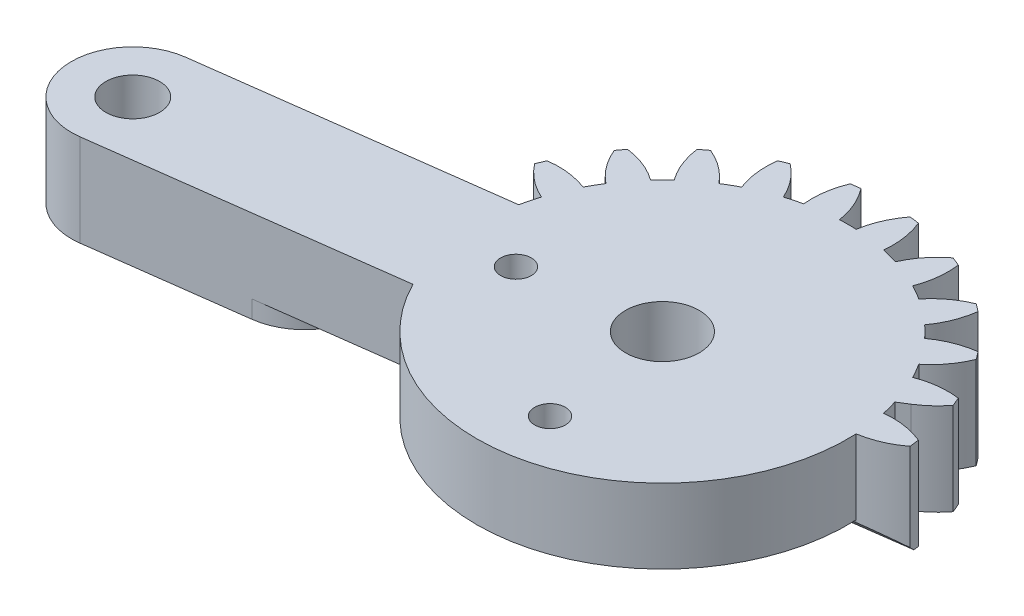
SolidWorks part; units mm, degrees
ref_plane "Front Plane" through (0, 0, 0) normal (0, 0, 1) x (1, 0, 0)
ref_plane "Top Plane" through (0, 0, 0) normal (0, 1, 0) x (1, 0, 0)
ref_plane "Right Plane" through (0, 0, 0) normal (1, 0, 0) x (0, 0, -1)
sketch "Sketch1" plane through (0, 0, 0) normal (0, 1, 0) x (1, 0, 0)
  line L0 (20.6437, 4) -> (2.0816, 4)
  line L1 (2.0816, -4) -> (20.6437, -4)
  arc A0 (2.0816, 4) -> (3.5217, 5.3071) centre (-0.7683, 8.5867) ccw
  arc A1 (3.5217, 5.3071) -> (3.2829, 5.8838) centre (-10.1063, 0) ccw
  arc A2 (3.2829, 5.8838) -> (0.6271, 5.5703) centre (2.5684, 0.5313) ccw
  arc A3 (0.6271, 5.5703) -> (0.0844, 6.5103) centre (-10.1063, 0) ccw
  arc A4 (0.0844, 6.5103) -> (1.6838, 8.6535) centre (-3.3089, 10.711) ccw
  arc A5 (1.6838, 8.6535) -> (1.3038, 9.1487) centre (-10.1063, 0) ccw
  arc A6 (1.3038, 9.1487) -> (-1.1803, 8.1585) centre (1.999, 3.7936) ccw
  arc A7 (-1.1803, 8.1585) -> (-1.9479, 8.926) centre (-10.1063, 0) ccw
  arc A8 (-1.9479, 8.926) -> (-0.9576, 11.4102) centre (-6.3127, 12.1053) ccw
  arc A9 (-0.9576, 11.4102) -> (-1.4528, 11.7901) centre (-10.1063, 0) ccw
  arc A10 (-1.4528, 11.7901) -> (-3.596, 10.1907) centre (0.6046, 6.7975) ccw
  arc A11 (-3.596, 10.1907) -> (-4.5361, 10.7334) centre (-10.1063, 0) ccw
  arc A12 (-4.5361, 10.7334) -> (-4.2225, 13.3892) centre (-9.5751, 12.6747) ccw
  arc A13 (-4.2225, 13.3892) -> (-4.7992, 13.6281) centre (-10.1063, 0) ccw
  arc A14 (-4.7992, 13.6281) -> (-6.4554, 11.5285) centre (-1.5196, 9.3381) ccw
  arc A15 (-6.4554, 11.5285) -> (-7.5039, 11.8094) centre (-10.1063, 0) ccw
  arc A16 (-7.5039, 11.8094) -> (-7.8884, 14.4558) centre (-12.8736, 12.3803) ccw
  arc A17 (-7.8884, 14.4558) -> (-8.5072, 14.5373) centre (-10.1063, 0) ccw
  arc A18 (-8.5072, 14.5373) -> (-9.5636, 12.0806) centre (-4.2291, 11.2423) ccw
  arc A19 (-9.5636, 12.0806) -> (-10.6491, 12.0806) centre (-10.1063, 0) ccw
  arc A20 (-10.6491, 12.0806) -> (-11.7054, 14.5373) centre (-15.9836, 11.2423) ccw
  arc A21 (-11.7054, 14.5373) -> (-12.3243, 14.4558) centre (-10.1063, 0) ccw
  arc A22 (-12.3243, 14.4558) -> (-12.7088, 11.8094) centre (-7.3391, 12.3803) ccw
  arc A23 (-12.7088, 11.8094) -> (-13.7573, 11.5285) centre (-10.1063, 0) ccw
  arc A24 (-13.7573, 11.5285) -> (-15.4135, 13.6281) centre (-18.6931, 9.3381) ccw
  arc A25 (-15.4135, 13.6281) -> (-15.9901, 13.3892) centre (-10.1063, 0) ccw
  arc A26 (-15.9901, 13.3892) -> (-15.6766, 10.7334) centre (-10.6376, 12.6747) ccw
  arc A27 (-15.6766, 10.7334) -> (-16.6166, 10.1907) centre (-10.1063, 0) ccw
  arc A28 (-16.6166, 10.1907) -> (-18.7599, 11.7901) centre (-20.8173, 6.7975) ccw
  arc A29 (-18.7599, 11.7901) -> (-19.255, 11.4102) centre (-10.1063, 0) ccw
  arc A30 (-19.255, 11.4102) -> (-18.2648, 8.926) centre (-13.9, 12.1053) ccw
  arc A31 (-18.2648, 8.926) -> (-19.0324, 8.1585) centre (-10.1063, 0) ccw
  arc A32 (-19.0324, 8.1585) -> (-21.5165, 9.1487) centre (-22.2117, 3.7936) ccw
  arc A33 (-21.5165, 9.1487) -> (-21.8965, 8.6535) centre (-10.1063, 0) ccw
  arc A34 (-21.8965, 8.6535) -> (-20.2971, 6.5103) centre (-16.9038, 10.711) ccw
  arc A35 (-20.2971, 6.5103) -> (-20.8398, 5.5703) centre (-10.1063, 0) ccw
  arc A36 (-20.8398, 5.5703) -> (-23.4956, 5.8838) centre (-22.7811, 0.5313) ccw
  arc A37 (-23.4956, 5.8838) -> (-23.7344, 5.3071) centre (-10.1063, 0) ccw
  arc A38 (-23.7344, 5.3071) -> (-21.6348, 3.6509) centre (-19.4444, 8.5867) ccw
  arc A39 (-21.6348, 3.6509) -> (-21.9157, 2.6025) centre (-10.1063, 0) ccw
  arc A40 (-21.9157, 2.6025) -> (-24.5622, 2.2179) centre (-22.4867, -2.7673) ccw
  arc A41 (-24.5622, 2.2179) -> (-24.6437, 1.5991) centre (-10.1063, 0) ccw
  arc A42 (-24.6437, 1.5991) -> (-22.1869, 0.5427) centre (-21.3486, 5.8773) ccw
  arc A43 (-22.1869, 0.5427) -> (-22.1869, -0.5427) centre (-10.1063, 0) ccw
  arc A44 (-22.1869, -0.5427) -> (-24.6437, -1.5991) centre (-21.3486, -5.8773) ccw
  arc A45 (-24.6437, -1.5991) -> (-24.5622, -2.2179) centre (-10.1063, 0) ccw
  arc A46 (-24.5622, -2.2179) -> (-21.9157, -2.6025) centre (-22.4867, 2.7673) ccw
  arc A47 (-21.9157, -2.6025) -> (-21.6348, -3.6509) centre (-10.1063, 0) ccw
  arc A48 (-21.6348, -3.6509) -> (-23.7344, -5.3071) centre (-19.4444, -8.5867) ccw
  arc A49 (-23.7344, -5.3071) -> (-23.4956, -5.8838) centre (-10.1063, 0) ccw
  arc A50 (-23.4956, -5.8838) -> (-20.8398, -5.5703) centre (-22.7811, -0.5313) ccw
  arc A51 (-20.8398, -5.5703) -> (-20.2971, -6.5103) centre (-10.1063, 0) ccw
  arc A52 (-20.2971, -6.5103) -> (-21.8965, -8.6535) centre (-16.9038, -10.711) ccw
  arc A53 (-21.8965, -8.6535) -> (-21.5165, -9.1487) centre (-10.1063, 0) ccw
  arc A54 (-21.5165, -9.1487) -> (-19.0324, -8.1585) centre (-22.2117, -3.7936) ccw
  arc A55 (-19.0324, -8.1585) -> (-18.2648, -8.926) centre (-10.1063, 0) ccw
  arc A56 (-18.2648, -8.926) -> (-19.255, -11.4102) centre (-13.9, -12.1053) ccw
  arc A57 (-19.255, -11.4102) -> (-18.7599, -11.7901) centre (-10.1063, 0) ccw
  arc A58 (-18.7599, -11.7901) -> (-16.6166, -10.1907) centre (-20.8173, -6.7975) ccw
  arc A59 (-16.6166, -10.1907) -> (-15.6766, -10.7334) centre (-10.1063, 0) ccw
  arc A60 (-15.6766, -10.7334) -> (-15.9901, -13.3892) centre (-10.6376, -12.6747) ccw
  arc A61 (-15.9901, -13.3892) -> (-15.4135, -13.6281) centre (-10.1063, 0) ccw
  arc A62 (-15.4135, -13.6281) -> (-13.7573, -11.5285) centre (-18.6931, -9.3381) ccw
  arc A63 (-13.7573, -11.5285) -> (-12.7088, -11.8094) centre (-10.1063, 0) ccw
  arc A64 (-12.7088, -11.8094) -> (-12.3243, -14.4558) centre (-7.3391, -12.3803) ccw
  arc A65 (-12.3243, -14.4558) -> (-11.7054, -14.5373) centre (-10.1063, 0) ccw
  arc A66 (-11.7054, -14.5373) -> (-10.6491, -12.0806) centre (-15.9836, -11.2423) ccw
  arc A67 (-10.6491, -12.0806) -> (-9.5636, -12.0806) centre (-10.1063, 0) ccw
  arc A68 (-9.5636, -12.0806) -> (-8.5072, -14.5373) centre (-4.2291, -11.2423) ccw
  arc A69 (-8.5072, -14.5373) -> (-7.8884, -14.4558) centre (-10.1063, 0) ccw
  arc A70 (-7.8884, -14.4558) -> (-7.5039, -11.8094) centre (-12.8736, -12.3803) ccw
  arc A71 (-7.5039, -11.8094) -> (-6.4554, -11.5285) centre (-10.1063, 0) ccw
  arc A72 (-6.4554, -11.5285) -> (-4.7992, -13.6281) centre (-1.5196, -9.3381) ccw
  arc A73 (-4.7992, -13.6281) -> (-4.2225, -13.3892) centre (-10.1063, 0) ccw
  arc A74 (-4.2225, -13.3892) -> (-4.5361, -10.7334) centre (-9.5751, -12.6747) ccw
  arc A75 (-4.5361, -10.7334) -> (-3.596, -10.1907) centre (-10.1063, 0) ccw
  arc A76 (-3.596, -10.1907) -> (-1.4528, -11.7901) centre (0.6046, -6.7975) ccw
  arc A77 (-1.4528, -11.7901) -> (-0.9576, -11.4102) centre (-10.1063, 0) ccw
  arc A78 (-0.9576, -11.4102) -> (-1.9479, -8.926) centre (-6.3127, -12.1053) ccw
  arc A79 (-1.9479, -8.926) -> (-1.1803, -8.1585) centre (-10.1063, 0) ccw
  arc A80 (-1.1803, -8.1585) -> (1.3038, -9.1487) centre (1.999, -3.7936) ccw
  arc A81 (1.3038, -9.1487) -> (1.6838, -8.6535) centre (-10.1063, 0) ccw
  arc A82 (1.6838, -8.6535) -> (0.0844, -6.5103) centre (-3.3089, -10.711) ccw
  arc A83 (0.0844, -6.5103) -> (0.6271, -5.5703) centre (-10.1063, 0) ccw
  arc A84 (0.6271, -5.5703) -> (3.2829, -5.8838) centre (2.5684, -0.5313) ccw
  arc A85 (3.2829, -5.8838) -> (3.5217, -5.3071) centre (-10.1063, 0) ccw
  arc A86 (3.5217, -5.3071) -> (2.0816, -4) centre (-0.7683, -8.5867) ccw
  arc A87 (20.6437, -4) -> (20.6437, 4) centre (20.6437, 0) ccw
  circle A88 centre (-10.1063, 0) radius 1.5
  circle A89 centre (20.6437, 0) radius 1.5
  dimension "D1" = 3
  dimension "D2" = 3
extrude "Boss-Extrude1" add sketch "Sketch1" along normal blind 4
sketch "Sketch3" plane through (0, 4, 0) normal (0, 1, 0) x (1, 0, 0)
  line L0 (-10.1063, 0) -> (-40.8563, 0) construction
  line L1 (-10.1063, 0) -> (-40.5933, -4.0137)
  line L2 (-10.6284, 3.9658) -> (-41.1154, -0.0479)
  line L3 (-9.5842, -3.9658) -> (-40.0712, -7.9795)
  line L4 (-10.1063, 0) -> (-4.5096, 13.5117) construction
  line L5 (-10.1063, 0) -> (-8.1974, 14.4999) construction
  circle A0 centre (-10.1063, 0) radius 1.5
  circle A1 centre (20.6437, 0) radius 1.5 construction
  circle A2 centre (20.6437, 0) radius 1.5
  circle A3 centre (-40.5933, -4.0137) radius 1.75
  circle A4 centre (-40.5933, -4.0137) radius 4
  circle A5 centre (-10.1063, 0) radius 4
  arc A6 (-4.2225, 13.3892) -> (-4.7992, 13.6281) centre (-10.1063, 0) ccw construction
  arc A7 (-7.8884, 14.4558) -> (-8.5072, 14.5373) centre (-10.1063, 0) ccw construction
  dimension "D2" = 3
  dimension "D5" = 3.5
  dimension "D6" = 8
  dimension "D7" = 8
  dimension "D1" = 30.75
  dimension "D4" = 7.5
extrude "Boss-Extrude2" add sketch "Sketch3" against normal blind 4
sketch "Sketch4" plane through (0, 4, 0) normal (0, 1, 0) x (1, 0, 0)
  line L0 (20.6437, 4) -> (2.0816, 4) construction
  line L1 (2.0816, -4) -> (20.6437, -4) construction
  line L2 (20.6437, 4) -> (2.0816, 4)
  line L3 (2.0816, -4) -> (20.6437, -4)
  line L4 (2.0816, 4) -> (1.4381, 3.6001)
  line L5 (-21.6245, -5.5509) -> (-20.8986, -5.4553)
  line L6 (-10.1063, 0) -> (0.0844, 6.5103) construction
  line L7 (-10.1063, 0) -> (1.9742, 0.5427) construction
  line L8 (-24.5755, 2.1296) -> (-41.1154, -0.0479)
  line L9 (-40.0712, -7.9795) -> (-23.5312, -5.8019)
  line L10 (2.0816, -4) -> (20.6437, -4)
  line L11 (20.6437, 4) -> (2.0816, 4)
  line L12 (-21.9429, 2.4762) -> (-41.1154, -0.0479)
  line L13 (-40.0712, -7.9795) -> (-21.6245, -5.5509)
  line L14 (2.0816, -4) -> (20.6437, -4)
  line L15 (20.6437, 4) -> (2.0816, 4)
  circle A0 centre (-10.1063, 0) radius 12.0927
  arc A1 (3.2829, 5.8838) -> (0.6271, 5.5703) centre (2.5684, 0.5313) ccw construction
  arc A2 (3.5217, 5.3071) -> (3.2829, 5.8838) centre (-10.1063, 0) ccw construction
  arc A3 (2.0816, 4) -> (3.5217, 5.3071) centre (-0.7683, 8.5867) ccw construction
  arc A4 (20.6437, -4) -> (20.6437, 4) centre (20.6437, 0) ccw construction
  arc A5 (3.5217, -5.3071) -> (2.0816, -4) centre (-0.7683, -8.5867) ccw construction
  arc A6 (3.2829, -5.8838) -> (3.5217, -5.3071) centre (-10.1063, 0) ccw construction
  arc A7 (0.6271, -5.5703) -> (3.2829, -5.8838) centre (2.5684, -0.5313) ccw construction
  arc A8 (3.2829, 5.8838) -> (0.6271, 5.5703) centre (2.5684, 0.5313) ccw
  arc A9 (3.5217, 5.3071) -> (3.2829, 5.8838) centre (-10.1063, 0) ccw
  arc A10 (2.0816, 4) -> (3.5217, 5.3071) centre (-0.7683, 8.5867) ccw
  arc A11 (20.6437, -4) -> (20.6437, 4) centre (20.6437, 0) ccw
  arc A12 (3.5217, -5.3071) -> (2.0816, -4) centre (-0.7683, -8.5867) ccw
  arc A13 (3.2829, -5.8838) -> (3.5217, -5.3071) centre (-10.1063, 0) ccw
  arc A14 (0.6271, -5.5703) -> (3.2829, -5.8838) centre (2.5684, -0.5313) ccw
  arc A15 (1.9742, 0.5427) -> (4.431, 1.5991) centre (1.1359, 5.8773) ccw
  arc A16 (4.3495, 2.2179) -> (1.7031, 2.6025) centre (2.274, -2.7673) ccw
  arc A17 (4.431, 1.5991) -> (4.3495, 2.2179) centre (-10.1063, 0) ccw
  arc A95 (-21.6348, 3.6509) -> (-21.9157, 2.6025) centre (-10.1063, 0) ccw
  arc A96 (-41.1154, -0.0479) -> (-40.0712, -7.9795) centre (-40.5933, -4.0137) ccw
  arc A97 (-20.2971, -6.5103) -> (-21.8965, -8.6535) centre (-16.9038, -10.711) ccw
  arc A98 (-21.8965, -8.6535) -> (-21.5165, -9.1487) centre (-10.1063, 0) ccw
  arc A99 (-21.5165, -9.1487) -> (-19.0324, -8.1585) centre (-22.2117, -3.7936) ccw
  arc A100 (-19.0324, -8.1585) -> (-18.2648, -8.926) centre (-10.1063, 0) ccw
  arc A101 (-18.2648, -8.926) -> (-19.255, -11.4102) centre (-13.9, -12.1053) ccw
  arc A102 (-19.255, -11.4102) -> (-18.7599, -11.7901) centre (-10.1063, 0) ccw
  arc A103 (-18.7599, -11.7901) -> (-16.6166, -10.1907) centre (-20.8173, -6.7975) ccw
  arc A104 (-16.6166, -10.1907) -> (-15.6766, -10.7334) centre (-10.1063, 0) ccw
  arc A105 (-15.6766, -10.7334) -> (-15.9901, -13.3892) centre (-10.6376, -12.6747) ccw
  arc A106 (-15.9901, -13.3892) -> (-15.4135, -13.6281) centre (-10.1063, 0) ccw
  arc A107 (-15.4135, -13.6281) -> (-13.7573, -11.5285) centre (-18.6931, -9.3381) ccw
  arc A108 (-13.7573, -11.5285) -> (-12.7088, -11.8094) centre (-10.1063, 0) ccw
  arc A109 (-12.7088, -11.8094) -> (-12.3243, -14.4558) centre (-7.3391, -12.3803) ccw
  arc A110 (-12.3243, -14.4558) -> (-11.7054, -14.5373) centre (-10.1063, 0) ccw
  arc A111 (-11.7054, -14.5373) -> (-10.6491, -12.0806) centre (-15.9836, -11.2423) ccw
  arc A112 (-10.6491, -12.0806) -> (-9.5636, -12.0806) centre (-10.1063, 0) ccw
  arc A113 (-9.5636, -12.0806) -> (-8.5072, -14.5373) centre (-4.2291, -11.2423) ccw
  arc A114 (-8.5072, -14.5373) -> (-7.8884, -14.4558) centre (-10.1063, 0) ccw
  arc A115 (-7.8884, -14.4558) -> (-7.5039, -11.8094) centre (-12.8736, -12.3803) ccw
  arc A116 (-7.5039, -11.8094) -> (-6.4554, -11.5285) centre (-10.1063, 0) ccw
  arc A117 (-6.4554, -11.5285) -> (-4.7992, -13.6281) centre (-1.5196, -9.3381) ccw
  arc A118 (-4.7992, -13.6281) -> (-4.2225, -13.3892) centre (-10.1063, 0) ccw
  arc A119 (-4.2225, -13.3892) -> (-4.5361, -10.7334) centre (-9.5751, -12.6747) ccw
  arc A120 (-4.5361, -10.7334) -> (-3.596, -10.1907) centre (-10.1063, 0) ccw
  arc A121 (-3.596, -10.1907) -> (-1.4528, -11.7901) centre (0.6046, -6.7975) ccw
  arc A122 (-1.4528, -11.7901) -> (-0.9576, -11.4102) centre (-10.1063, 0) ccw
  arc A123 (-0.9576, -11.4102) -> (-1.9479, -8.926) centre (-6.3127, -12.1053) ccw
  arc A124 (-1.9479, -8.926) -> (-1.1803, -8.1585) centre (-10.1063, 0) ccw
  arc A125 (-1.1803, -8.1585) -> (1.3038, -9.1487) centre (1.999, -3.7936) ccw
  arc A126 (1.3038, -9.1487) -> (1.6838, -8.6535) centre (-10.1063, 0) ccw
  arc A127 (1.6838, -8.6535) -> (0.0844, -6.5103) centre (-3.3089, -10.711) ccw
  arc A128 (0.0844, -6.5103) -> (0.6271, -5.5703) centre (-10.1063, 0) ccw
  arc A129 (0.6271, -5.5703) -> (3.2829, -5.8838) centre (2.5684, -0.5313) ccw
  arc A130 (3.2829, -5.8838) -> (3.5217, -5.3071) centre (-10.1063, 0) ccw
  arc A131 (3.5217, -5.3071) -> (2.0816, -4) centre (-0.7683, -8.5867) ccw
  arc A132 (20.6437, -4) -> (20.6437, 4) centre (20.6437, 0) ccw
  arc A133 (2.0816, 4) -> (3.5217, 5.3071) centre (-0.7683, 8.5867) ccw
  arc A134 (3.5217, 5.3071) -> (3.2829, 5.8838) centre (-10.1063, 0) ccw
  arc A135 (3.2829, 5.8838) -> (0.6271, 5.5703) centre (2.5684, 0.5313) ccw
  arc A136 (0.6271, 5.5703) -> (0.0844, 6.5103) centre (-10.1063, 0) ccw
  arc A137 (0.0844, 6.5103) -> (1.6838, 8.6535) centre (-3.3089, 10.711) ccw
  arc A138 (1.6838, 8.6535) -> (1.3038, 9.1487) centre (-10.1063, 0) ccw
  arc A139 (1.3038, 9.1487) -> (-1.1803, 8.1585) centre (1.999, 3.7936) ccw
  arc A140 (-1.1803, 8.1585) -> (-1.9479, 8.926) centre (-10.1063, 0) ccw
  arc A141 (-1.9479, 8.926) -> (-0.9576, 11.4102) centre (-6.3127, 12.1053) ccw
  arc A142 (-0.9576, 11.4102) -> (-1.4528, 11.7901) centre (-10.1063, 0) ccw
  arc A143 (-1.4528, 11.7901) -> (-3.596, 10.1907) centre (0.6046, 6.7975) ccw
  arc A144 (-3.596, 10.1907) -> (-4.5361, 10.7334) centre (-10.1063, 0) ccw
  arc A145 (-4.5361, 10.7334) -> (-4.2225, 13.3892) centre (-9.5751, 12.6747) ccw
  arc A146 (-4.2225, 13.3892) -> (-4.7992, 13.6281) centre (-10.1063, 0) ccw
  arc A147 (-4.7992, 13.6281) -> (-6.4554, 11.5285) centre (-1.5196, 9.3381) ccw
  arc A148 (-6.4554, 11.5285) -> (-7.5039, 11.8094) centre (-10.1063, 0) ccw
  arc A149 (-7.5039, 11.8094) -> (-7.8884, 14.4558) centre (-12.8736, 12.3803) ccw
  arc A150 (-7.8884, 14.4558) -> (-8.5072, 14.5373) centre (-10.1063, 0) ccw
  arc A151 (-8.5072, 14.5373) -> (-9.5636, 12.0806) centre (-4.2291, 11.2423) ccw
  arc A152 (-9.5636, 12.0806) -> (-10.6491, 12.0806) centre (-10.1063, 0) ccw
  arc A153 (-10.6491, 12.0806) -> (-11.7054, 14.5373) centre (-15.9836, 11.2423) ccw
  arc A154 (-11.7054, 14.5373) -> (-12.3243, 14.4558) centre (-10.1063, 0) ccw
  arc A155 (-12.3243, 14.4558) -> (-12.7088, 11.8094) centre (-7.3391, 12.3803) ccw
  arc A156 (-12.7088, 11.8094) -> (-13.7573, 11.5285) centre (-10.1063, 0) ccw
  arc A157 (-13.7573, 11.5285) -> (-15.4135, 13.6281) centre (-18.6931, 9.3381) ccw
  arc A158 (-15.4135, 13.6281) -> (-15.9901, 13.3892) centre (-10.1063, 0) ccw
  arc A159 (-15.9901, 13.3892) -> (-15.6766, 10.7334) centre (-10.6376, 12.6747) ccw
  arc A160 (-15.6766, 10.7334) -> (-16.6166, 10.1907) centre (-10.1063, 0) ccw
  arc A161 (-16.6166, 10.1907) -> (-18.7599, 11.7901) centre (-20.8173, 6.7975) ccw
  arc A162 (-18.7599, 11.7901) -> (-19.255, 11.4102) centre (-10.1063, 0) ccw
  arc A163 (-19.255, 11.4102) -> (-18.2648, 8.926) centre (-13.9, 12.1053) ccw
  arc A164 (-18.2648, 8.926) -> (-19.0324, 8.1585) centre (-10.1063, 0) ccw
  arc A165 (-19.0324, 8.1585) -> (-21.5165, 9.1487) centre (-22.2117, 3.7936) ccw
  arc A166 (-21.5165, 9.1487) -> (-21.8965, 8.6535) centre (-10.1063, 0) ccw
  arc A167 (-21.8965, 8.6535) -> (-20.2971, 6.5103) centre (-16.9038, 10.711) ccw
  arc A168 (-20.2971, 6.5103) -> (-20.8398, 5.5703) centre (-10.1063, 0) ccw
  arc A169 (-20.8398, 5.5703) -> (-23.4956, 5.8838) centre (-22.7811, 0.5313) ccw
  arc A170 (-23.4956, 5.8838) -> (-23.7344, 5.3071) centre (-10.1063, 0) ccw
  arc A171 (-23.7344, 5.3071) -> (-21.6348, 3.6509) centre (-19.4444, 8.5867) ccw
  arc A172 (-21.6348, 3.6509) -> (-21.9157, 2.6025) centre (-10.1063, 0) ccw
  arc A175 (-23.4956, -5.8838) -> (-20.8398, -5.5703) centre (-22.7811, -0.5313) ccw
  arc A176 (-41.1154, -0.0479) -> (-40.0712, -7.9795) centre (-40.5933, -4.0137) ccw
  arc A177 (-20.2971, -6.5103) -> (-21.8965, -8.6535) centre (-16.9038, -10.711) ccw
  arc A178 (-21.8965, -8.6535) -> (-21.5165, -9.1487) centre (-10.1063, 0) ccw
  arc A179 (-21.5165, -9.1487) -> (-19.0324, -8.1585) centre (-22.2117, -3.7936) ccw
  arc A180 (-19.0324, -8.1585) -> (-18.2648, -8.926) centre (-10.1063, 0) ccw
  arc A181 (-18.2648, -8.926) -> (-19.255, -11.4102) centre (-13.9, -12.1053) ccw
  arc A182 (-19.255, -11.4102) -> (-18.7599, -11.7901) centre (-10.1063, 0) ccw
  arc A183 (-18.7599, -11.7901) -> (-16.6166, -10.1907) centre (-20.8173, -6.7975) ccw
  arc A184 (-16.6166, -10.1907) -> (-15.6766, -10.7334) centre (-10.1063, 0) ccw
  arc A185 (-15.6766, -10.7334) -> (-15.9901, -13.3892) centre (-10.6376, -12.6747) ccw
  arc A186 (-15.9901, -13.3892) -> (-15.4135, -13.6281) centre (-10.1063, 0) ccw
  arc A187 (-15.4135, -13.6281) -> (-13.7573, -11.5285) centre (-18.6931, -9.3381) ccw
  arc A188 (-13.7573, -11.5285) -> (-12.7088, -11.8094) centre (-10.1063, 0) ccw
  arc A189 (-12.7088, -11.8094) -> (-12.3243, -14.4558) centre (-7.3391, -12.3803) ccw
  arc A190 (-12.3243, -14.4558) -> (-11.7054, -14.5373) centre (-10.1063, 0) ccw
  arc A191 (-11.7054, -14.5373) -> (-10.6491, -12.0806) centre (-15.9836, -11.2423) ccw
  arc A192 (-10.6491, -12.0806) -> (-9.5636, -12.0806) centre (-10.1063, 0) ccw
  arc A193 (-9.5636, -12.0806) -> (-8.5072, -14.5373) centre (-4.2291, -11.2423) ccw
  arc A194 (-8.5072, -14.5373) -> (-7.8884, -14.4558) centre (-10.1063, 0) ccw
  arc A195 (-7.8884, -14.4558) -> (-7.5039, -11.8094) centre (-12.8736, -12.3803) ccw
  arc A196 (-7.5039, -11.8094) -> (-6.4554, -11.5285) centre (-10.1063, 0) ccw
  arc A197 (-6.4554, -11.5285) -> (-4.7992, -13.6281) centre (-1.5196, -9.3381) ccw
  arc A198 (-4.7992, -13.6281) -> (-4.2225, -13.3892) centre (-10.1063, 0) ccw
  arc A199 (-4.2225, -13.3892) -> (-4.5361, -10.7334) centre (-9.5751, -12.6747) ccw
  arc A200 (-4.5361, -10.7334) -> (-3.596, -10.1907) centre (-10.1063, 0) ccw
  arc A201 (-3.596, -10.1907) -> (-1.4528, -11.7901) centre (0.6046, -6.7975) ccw
  arc A202 (-1.4528, -11.7901) -> (-0.9576, -11.4102) centre (-10.1063, 0) ccw
  arc A203 (-0.9576, -11.4102) -> (-1.9479, -8.926) centre (-6.3127, -12.1053) ccw
  arc A204 (-1.9479, -8.926) -> (-1.1803, -8.1585) centre (-10.1063, 0) ccw
  arc A205 (-1.1803, -8.1585) -> (1.3038, -9.1487) centre (1.999, -3.7936) ccw
  arc A206 (1.3038, -9.1487) -> (1.6838, -8.6535) centre (-10.1063, 0) ccw
  arc A207 (1.6838, -8.6535) -> (0.0844, -6.5103) centre (-3.3089, -10.711) ccw
  arc A208 (0.0844, -6.5103) -> (0.6271, -5.5703) centre (-10.1063, 0) ccw
  arc A209 (0.6271, -5.5703) -> (3.2829, -5.8838) centre (2.5684, -0.5313) ccw
  arc A210 (3.2829, -5.8838) -> (3.5217, -5.3071) centre (-10.1063, 0) ccw
  arc A211 (3.5217, -5.3071) -> (2.0816, -4) centre (-0.7683, -8.5867) ccw
  arc A212 (20.6437, -4) -> (20.6437, 4) centre (20.6437, 0) ccw
  arc A213 (2.0816, 4) -> (3.5217, 5.3071) centre (-0.7683, 8.5867) ccw
  arc A214 (3.5217, 5.3071) -> (3.2829, 5.8838) centre (-10.1063, 0) ccw
  arc A215 (3.2829, 5.8838) -> (0.6271, 5.5703) centre (2.5684, 0.5313) ccw
  arc A216 (0.6271, 5.5703) -> (0.0844, 6.5103) centre (-10.1063, 0) ccw
  arc A217 (0.0844, 6.5103) -> (1.6838, 8.6535) centre (-3.3089, 10.711) ccw
  arc A218 (1.6838, 8.6535) -> (1.3038, 9.1487) centre (-10.1063, 0) ccw
  arc A219 (1.3038, 9.1487) -> (-1.1803, 8.1585) centre (1.999, 3.7936) ccw
  arc A220 (-1.1803, 8.1585) -> (-1.9479, 8.926) centre (-10.1063, 0) ccw
  arc A221 (-1.9479, 8.926) -> (-0.9576, 11.4102) centre (-6.3127, 12.1053) ccw
  arc A222 (-0.9576, 11.4102) -> (-1.4528, 11.7901) centre (-10.1063, 0) ccw
  arc A223 (-1.4528, 11.7901) -> (-3.596, 10.1907) centre (0.6046, 6.7975) ccw
  arc A224 (-3.596, 10.1907) -> (-4.5361, 10.7334) centre (-10.1063, 0) ccw
  arc A225 (-4.5361, 10.7334) -> (-4.2225, 13.3892) centre (-9.5751, 12.6747) ccw
  arc A226 (-4.2225, 13.3892) -> (-4.7992, 13.6281) centre (-10.1063, 0) ccw
  arc A227 (-4.7992, 13.6281) -> (-6.4554, 11.5285) centre (-1.5196, 9.3381) ccw
  arc A228 (-6.4554, 11.5285) -> (-7.5039, 11.8094) centre (-10.1063, 0) ccw
  arc A229 (-7.5039, 11.8094) -> (-7.8884, 14.4558) centre (-12.8736, 12.3803) ccw
  arc A230 (-7.8884, 14.4558) -> (-8.5072, 14.5373) centre (-10.1063, 0) ccw
  arc A231 (-8.5072, 14.5373) -> (-9.5636, 12.0806) centre (-4.2291, 11.2423) ccw
  arc A232 (-9.5636, 12.0806) -> (-10.6491, 12.0806) centre (-10.1063, 0) ccw
  arc A233 (-10.6491, 12.0806) -> (-11.7054, 14.5373) centre (-15.9836, 11.2423) ccw
  arc A234 (-11.7054, 14.5373) -> (-12.3243, 14.4558) centre (-10.1063, 0) ccw
  arc A235 (-12.3243, 14.4558) -> (-12.7088, 11.8094) centre (-7.3391, 12.3803) ccw
  arc A236 (-12.7088, 11.8094) -> (-13.7573, 11.5285) centre (-10.1063, 0) ccw
  arc A237 (-13.7573, 11.5285) -> (-15.4135, 13.6281) centre (-18.6931, 9.3381) ccw
  arc A238 (-15.4135, 13.6281) -> (-15.9901, 13.3892) centre (-10.1063, 0) ccw
  arc A239 (-15.9901, 13.3892) -> (-15.6766, 10.7334) centre (-10.6376, 12.6747) ccw
  arc A240 (-15.6766, 10.7334) -> (-16.6166, 10.1907) centre (-10.1063, 0) ccw
  arc A241 (-16.6166, 10.1907) -> (-18.7599, 11.7901) centre (-20.8173, 6.7975) ccw
  arc A242 (-18.7599, 11.7901) -> (-19.255, 11.4102) centre (-10.1063, 0) ccw
  arc A243 (-19.255, 11.4102) -> (-18.2648, 8.926) centre (-13.9, 12.1053) ccw
  arc A244 (-18.2648, 8.926) -> (-19.0324, 8.1585) centre (-10.1063, 0) ccw
  arc A245 (-19.0324, 8.1585) -> (-21.5165, 9.1487) centre (-22.2117, 3.7936) ccw
  arc A246 (-21.5165, 9.1487) -> (-21.8965, 8.6535) centre (-10.1063, 0) ccw
  arc A247 (-21.8965, 8.6535) -> (-20.2971, 6.5103) centre (-16.9038, 10.711) ccw
  arc A248 (-20.2971, 6.5103) -> (-20.8398, 5.5703) centre (-10.1063, 0) ccw
  arc A249 (-20.8398, 5.5703) -> (-23.4956, 5.8838) centre (-22.7811, 0.5313) ccw
  arc A250 (-23.4956, 5.8838) -> (-23.7344, 5.3071) centre (-10.1063, 0) ccw
  arc A251 (-23.7344, 5.3071) -> (-21.6348, 3.6509) centre (-19.4444, 8.5867) ccw
  arc A252 (-23.4956, -5.8838) -> (-20.8398, -5.5703) centre (-22.7811, -0.5313) ccw
  arc A253 (-20.8398, -5.5703) -> (-20.2971, -6.5103) centre (-10.1063, 0) ccw
  arc A254 (-20.8398, -5.5703) -> (-20.2971, -6.5103) centre (-10.1063, 0) ccw
  arc A255 (-23.5312, -5.8019) -> (-23.4956, -5.8838) centre (-10.1063, 0) ccw
  arc A256 (-23.5312, -5.8019) -> (-23.4956, -5.8838) centre (-10.1063, 0) ccw
  arc A257 (-21.9157, 2.6025) -> (-24.5622, 2.2179) centre (-22.4867, -2.7673) ccw
  arc A258 (-21.9157, 2.6025) -> (-24.5622, 2.2179) centre (-22.4867, -2.7673) ccw
  arc A259 (-24.5622, 2.2179) -> (-24.5755, 2.1296) centre (-10.1063, 0) ccw
  arc A260 (-24.5622, 2.2179) -> (-24.5755, 2.1296) centre (-10.1063, 0) ccw
  point P40 (-10.1063, 0)
  dimension "D2" = 24.1855
  dimension "D4" = 30
  dimension "D1" = 0
  dimension "D3" = 2
extrude "Cut-Extrude1" cut sketch "Sketch4" against normal blind 4 contours A178 A179 A0 L5 A177 | A182 A183 A0 A181 | A186 A187 A0 A185 | A190 A191 A0 A189 | A194 A195 A0 A193 | A198 A199 A0 A197 | A202 A203 A0 A201 | A206 A207 A0 A205 | A258 A260 L12 A0 | L13 A256 A252 A0 L5 | A0 A14 A13 A12 L3 A11 L2 L4
sketch "Sketch5" plane through (0, 4, 0) normal (0, 1, 0) x (1, 0, 0)
  line L0 (-10.1063, 0) -> (-40.5933, -4.0137) construction
  line L1 (-10.1063, 0) -> (-8.9969, -8.4273) construction
  circle A0 centre (-10.1063, 0) radius 2.4
  circle A2 centre (-14.5678, -0.5874) radius 1
  circle A4 centre (-18.5336, -1.1095) radius 1
  circle A6 centre (-8.9969, -8.4273) radius 1
  dimension "D1" = 4.8
  dimension "D2" = 4.5
  dimension "D3" = 2
  dimension "D4" = 2
  dimension "D6" = 90
  dimension "D7" = 8.5
  dimension "D8" = 2
  dimension "D5" = 4
extrude "Cut-Extrude2" cut sketch "Sketch5" against normal up to next contours A0 | A4 | A6
sketch "Sketch7" plane through (0, 4, 0) normal (0, 1, 0) x (1, 0, 0)
  circle A0 centre (-10.1063, 0) radius 13.45 construction
  circle A1 centre (-10.1063, 0) radius 13.45
sketch "Sketch8" plane through (0, 0, 0) normal (0, -1, 0) x (1, 0, 0)
  line L0 (-30.6788, 2.7084) -> (-40.5933, 4.0137) construction
  line L1 (-20.8986, 5.4553) -> (-40.0712, 7.9795) construction
  line L2 (-30.1567, 6.6742) -> (-40.0712, 7.9795)
  line L3 (-21.9429, -2.4762) -> (-41.1154, 0.0479) construction
  line L4 (-31.2009, -1.2574) -> (-41.1154, 0.0479)
  arc A0 (-31.2009, -1.2574) -> (-30.1567, 6.6742) centre (-30.6788, 2.7084) ccw
  arc A1 (-40.0712, 7.9795) -> (-41.1154, 0.0479) centre (-40.5933, 4.0137) ccw construction
  arc A2 (-40.0712, 7.9795) -> (-41.1154, 0.0479) centre (-40.5933, 4.0137) ccw
  circle A3 centre (-40.5933, 4.0137) radius 1.75 construction
  circle A4 centre (-40.5933, 4.0137) radius 1.75
  dimension "D1" = 10
extrude "Boss-Extrude3" add sketch "Sketch8" along normal blind 2
sketch "Sketch10" plane through (0, 0, 0) normal (0, -1, 0) x (1, 0, 0)
  line L1 (1.9742, -0.5427) -> (-2.0136, 0)
  line L2 (-21.9429, -2.4762) -> (-17.6034, -3.0475)
  line L3 (-31.2009, -1.2574) -> (-21.9429, -2.4762)
  line L4 (2.0816, -4) -> (1.4381, -3.6001)
  line L5 (-20.8986, 5.4553) -> (-30.1567, 6.6742)
  line L7 (2.0816, -4) -> (1.4381, -3.6001)
  line L8 (-20.8986, 5.4553) -> (-30.1567, 6.6742)
  line L9 (-21.9429, -2.4762) -> (-31.2009, -1.2574) construction
  arc A0 (-17.6034, -3.0475) -> (-2.0136, 0) centre (-10.1063, 0) ccw
  circle A1 centre (-10.1063, 0) radius 7 construction
  arc A46 (-31.2009, -1.2574) -> (-30.1567, 6.6742) centre (-30.6788, 2.7084) ccw
  arc A47 (-21.9429, -2.4762) -> (-21.6348, -3.6509) centre (-10.1063, 0) ccw
  arc A48 (-21.6348, -3.6509) -> (-23.7344, -5.3071) centre (-19.4444, -8.5867) ccw
  arc A49 (-23.7344, -5.3071) -> (-23.4956, -5.8838) centre (-10.1063, 0) ccw
  arc A50 (-23.4956, -5.8838) -> (-20.8398, -5.5703) centre (-22.7811, -0.5313) ccw
  arc A51 (-20.8398, -5.5703) -> (-20.2971, -6.5103) centre (-10.1063, 0) ccw
  arc A52 (-20.2971, -6.5103) -> (-21.8965, -8.6535) centre (-16.9038, -10.711) ccw
  arc A53 (-21.8965, -8.6535) -> (-21.5165, -9.1487) centre (-10.1063, 0) ccw
  arc A54 (-21.5165, -9.1487) -> (-19.0324, -8.1585) centre (-22.2117, -3.7936) ccw
  arc A55 (-19.0324, -8.1585) -> (-18.2648, -8.926) centre (-10.1063, 0) ccw
  arc A56 (-18.2648, -8.926) -> (-19.255, -11.4102) centre (-13.9, -12.1053) ccw
  arc A57 (-19.255, -11.4102) -> (-18.7599, -11.7901) centre (-10.1063, 0) ccw
  arc A58 (-18.7599, -11.7901) -> (-16.6166, -10.1907) centre (-20.8173, -6.7975) ccw
  arc A59 (-16.6166, -10.1907) -> (-15.6766, -10.7334) centre (-10.1063, 0) ccw
  arc A60 (-15.6766, -10.7334) -> (-15.9901, -13.3892) centre (-10.6376, -12.6747) ccw
  arc A61 (-15.9901, -13.3892) -> (-15.4135, -13.6281) centre (-10.1063, 0) ccw
  arc A62 (-15.4135, -13.6281) -> (-13.7573, -11.5285) centre (-18.6931, -9.3381) ccw
  arc A63 (-13.7573, -11.5285) -> (-12.7088, -11.8094) centre (-10.1063, 0) ccw
  arc A64 (-12.7088, -11.8094) -> (-12.3243, -14.4558) centre (-7.3391, -12.3803) ccw
  arc A65 (-12.3243, -14.4558) -> (-11.7054, -14.5373) centre (-10.1063, 0) ccw
  arc A66 (-11.7054, -14.5373) -> (-10.6491, -12.0806) centre (-15.9836, -11.2423) ccw
  arc A67 (-10.6491, -12.0806) -> (-9.5636, -12.0806) centre (-10.1063, 0) ccw
  arc A68 (-9.5636, -12.0806) -> (-8.5072, -14.5373) centre (-4.2291, -11.2423) ccw
  arc A69 (-8.5072, -14.5373) -> (-7.8884, -14.4558) centre (-10.1063, 0) ccw
  arc A70 (-7.8884, -14.4558) -> (-7.5039, -11.8094) centre (-12.8736, -12.3803) ccw
  arc A71 (-7.5039, -11.8094) -> (-6.4554, -11.5285) centre (-10.1063, 0) ccw
  arc A72 (-6.4554, -11.5285) -> (-4.7992, -13.6281) centre (-1.5196, -9.3381) ccw
  arc A73 (-4.7992, -13.6281) -> (-4.2225, -13.3892) centre (-10.1063, 0) ccw
  arc A74 (-4.2225, -13.3892) -> (-4.5361, -10.7334) centre (-9.5751, -12.6747) ccw
  arc A75 (-4.5361, -10.7334) -> (-3.596, -10.1907) centre (-10.1063, 0) ccw
  arc A76 (-3.596, -10.1907) -> (-1.4528, -11.7901) centre (0.6046, -6.7975) ccw
  arc A77 (-1.4528, -11.7901) -> (-0.9576, -11.4102) centre (-10.1063, 0) ccw
  arc A78 (-0.9576, -11.4102) -> (-1.9479, -8.926) centre (-6.3127, -12.1053) ccw
  arc A79 (-1.9479, -8.926) -> (-1.1803, -8.1585) centre (-10.1063, 0) ccw
  arc A80 (-1.1803, -8.1585) -> (1.3038, -9.1487) centre (1.999, -3.7936) ccw
  arc A81 (1.3038, -9.1487) -> (1.6838, -8.6535) centre (-10.1063, 0) ccw
  arc A82 (1.6838, -8.6535) -> (0.0844, -6.5103) centre (-3.3089, -10.711) ccw
  arc A83 (0.0844, -6.5103) -> (0.6271, -5.5703) centre (-10.1063, 0) ccw
  arc A84 (0.6271, -5.5703) -> (3.2829, -5.8838) centre (2.5684, -0.5313) ccw
  arc A85 (3.2829, -5.8838) -> (3.5217, -5.3071) centre (-10.1063, 0) ccw
  arc A86 (3.5217, -5.3071) -> (2.0816, -4) centre (-0.7683, -8.5867) ccw
  arc A87 (1.4381, -3.6001) -> (1.7031, -2.6025) centre (-10.1063, 0) ccw
  arc A88 (1.7031, -2.6025) -> (4.3495, -2.2179) centre (2.274, 2.7673) ccw
  arc A89 (4.3495, -2.2179) -> (4.431, -1.5991) centre (-10.1063, 0) ccw
  arc A90 (4.431, -1.5991) -> (1.9742, -0.5427) centre (1.1359, -5.8773) ccw
  arc A91 (1.9742, -0.5427) -> (-20.8986, 5.4553) centre (-10.1063, 0) ccw
  arc A92 (-31.2009, -1.2574) -> (-30.1567, 6.6742) centre (-30.6788, 2.7084) ccw
  arc A93 (-21.9429, -2.4762) -> (-21.6348, -3.6509) centre (-10.1063, 0) ccw
  arc A94 (-21.6348, -3.6509) -> (-23.7344, -5.3071) centre (-19.4444, -8.5867) ccw
  arc A95 (-23.7344, -5.3071) -> (-23.4956, -5.8838) centre (-10.1063, 0) ccw
  arc A96 (-23.4956, -5.8838) -> (-20.8398, -5.5703) centre (-22.7811, -0.5313) ccw
  arc A97 (-20.8398, -5.5703) -> (-20.2971, -6.5103) centre (-10.1063, 0) ccw
  arc A98 (-20.2971, -6.5103) -> (-21.8965, -8.6535) centre (-16.9038, -10.711) ccw
  arc A99 (-21.8965, -8.6535) -> (-21.5165, -9.1487) centre (-10.1063, 0) ccw
  arc A100 (-21.5165, -9.1487) -> (-19.0324, -8.1585) centre (-22.2117, -3.7936) ccw
  arc A101 (-19.0324, -8.1585) -> (-18.2648, -8.926) centre (-10.1063, 0) ccw
  arc A102 (-18.2648, -8.926) -> (-19.255, -11.4102) centre (-13.9, -12.1053) ccw
  arc A103 (-19.255, -11.4102) -> (-18.7599, -11.7901) centre (-10.1063, 0) ccw
  arc A104 (-18.7599, -11.7901) -> (-16.6166, -10.1907) centre (-20.8173, -6.7975) ccw
  arc A105 (-16.6166, -10.1907) -> (-15.6766, -10.7334) centre (-10.1063, 0) ccw
  arc A106 (-15.6766, -10.7334) -> (-15.9901, -13.3892) centre (-10.6376, -12.6747) ccw
  arc A107 (-15.9901, -13.3892) -> (-15.4135, -13.6281) centre (-10.1063, 0) ccw
  arc A108 (-15.4135, -13.6281) -> (-13.7573, -11.5285) centre (-18.6931, -9.3381) ccw
  arc A109 (-13.7573, -11.5285) -> (-12.7088, -11.8094) centre (-10.1063, 0) ccw
  arc A110 (-12.7088, -11.8094) -> (-12.3243, -14.4558) centre (-7.3391, -12.3803) ccw
  arc A111 (-12.3243, -14.4558) -> (-11.7054, -14.5373) centre (-10.1063, 0) ccw
  arc A112 (-11.7054, -14.5373) -> (-10.6491, -12.0806) centre (-15.9836, -11.2423) ccw
  arc A113 (-10.6491, -12.0806) -> (-9.5636, -12.0806) centre (-10.1063, 0) ccw
  arc A114 (-9.5636, -12.0806) -> (-8.5072, -14.5373) centre (-4.2291, -11.2423) ccw
  arc A115 (-8.5072, -14.5373) -> (-7.8884, -14.4558) centre (-10.1063, 0) ccw
  arc A116 (-7.8884, -14.4558) -> (-7.5039, -11.8094) centre (-12.8736, -12.3803) ccw
  arc A117 (-7.5039, -11.8094) -> (-6.4554, -11.5285) centre (-10.1063, 0) ccw
  arc A118 (-6.4554, -11.5285) -> (-4.7992, -13.6281) centre (-1.5196, -9.3381) ccw
  arc A119 (-4.7992, -13.6281) -> (-4.2225, -13.3892) centre (-10.1063, 0) ccw
  arc A120 (-4.2225, -13.3892) -> (-4.5361, -10.7334) centre (-9.5751, -12.6747) ccw
  arc A121 (-4.5361, -10.7334) -> (-3.596, -10.1907) centre (-10.1063, 0) ccw
  arc A122 (-3.596, -10.1907) -> (-1.4528, -11.7901) centre (0.6046, -6.7975) ccw
  arc A123 (-1.4528, -11.7901) -> (-0.9576, -11.4102) centre (-10.1063, 0) ccw
  arc A124 (-0.9576, -11.4102) -> (-1.9479, -8.926) centre (-6.3127, -12.1053) ccw
  arc A125 (-1.9479, -8.926) -> (-1.1803, -8.1585) centre (-10.1063, 0) ccw
  arc A126 (-1.1803, -8.1585) -> (1.3038, -9.1487) centre (1.999, -3.7936) ccw
  arc A127 (1.3038, -9.1487) -> (1.6838, -8.6535) centre (-10.1063, 0) ccw
  arc A128 (1.6838, -8.6535) -> (0.0844, -6.5103) centre (-3.3089, -10.711) ccw
  arc A129 (0.0844, -6.5103) -> (0.6271, -5.5703) centre (-10.1063, 0) ccw
  arc A130 (0.6271, -5.5703) -> (3.2829, -5.8838) centre (2.5684, -0.5313) ccw
  arc A131 (3.2829, -5.8838) -> (3.5217, -5.3071) centre (-10.1063, 0) ccw
  arc A132 (3.5217, -5.3071) -> (2.0816, -4) centre (-0.7683, -8.5867) ccw
  arc A133 (1.4381, -3.6001) -> (1.7031, -2.6025) centre (-10.1063, 0) ccw
  arc A134 (1.7031, -2.6025) -> (4.3495, -2.2179) centre (2.274, 2.7673) ccw
  arc A135 (4.3495, -2.2179) -> (4.431, -1.5991) centre (-10.1063, 0) ccw
  arc A136 (4.431, -1.5991) -> (1.9742, -0.5427) centre (1.1359, -5.8773) ccw
  dimension "D2" = 4
  dimension "D3" = 14
  dimension "D1" = 0
extrude "Boss-Extrude4" add sketch "Sketch10" along normal up to surface (2 mm away) contours A93 A94 A95 A96 A97 A98 A99 A100 A101 A102 A103 A104 A105 A106 A107 A108 A109 A110 A111 A112 A113 A114 A115 A116 A117 A118 A119 A120 A121 A122 A123 A124 A125 A126 A127 A128 A129 A130 A131 A132 L7 A133 A134 A135 A136 L1 A0 L2
fillet "Fillet1" radius 1 3 edges at (-19.7731, 0, -2.7619) (-8.5537, 0, -7.9424) (-0.0197, 0, -0.2714)
chamfer "Chamfer1" distance 1 angle 45 3 edges at (-19.7731, -2, -2.7619) (-8.5537, -2, -7.9424) (-0.0197, -2, -0.2714)
sketch "Sketch11" plane through (0, 0, 0) normal (0, -1, 0) x (1, 0, 0)
  line L0 (-10.1063, 0) -> (-18.5336, 1.1095) construction
  line L1 (-10.1063, 0) -> (-9.5137, 4.5015) construction
  line L2 (-4.6596, 3.0653) -> (-14.5741, 4.3705) construction
  line L3 (-5.6386, -4.3705) -> (-15.553, -3.0653) construction
  line L4 (-5.6386, -4.3705) -> (-4.5565, 3.8489) construction
  line L5 (-15.553, -3.0653) -> (-14.5741, 4.3705) construction
  line L6 (-5.1491, -0.6526) -> (-4.5565, 3.8489) construction
  line L7 (-9.6169, 3.7179) -> (-18.0442, 4.8274) construction
  line L8 (-15.0636, 0.6526) -> (-14.4709, 5.1541) construction
  line L9 (-10.5958, -3.7179) -> (-19.0231, -2.6084) construction
  line L10 (-4.2041, 5.0226) -> (-14.5075, 6.379)
  line L11 (-15.9131, 5.1326) -> (-16.87, -2.1354)
  line L14 (-31.2009, -1.2574) -> (-21.9429, -2.4762)
  line L15 (-22.1124, -1.4453) -> (-16.87, -2.1354)
  line L17 (-20.8986, 5.4553) -> (-30.1567, 6.6742)
  line L18 (-31.2009, -1.2574) -> (-21.9429, -2.4762)
  line L21 (-20.8986, 5.4553) -> (-30.1567, 6.6742)
  line L27 (-22.1124, -1.4453) -> (-16.87, -2.1354)
  line L29 (-3.1088, 1.1583) -> (1.9774, 0.4661)
  line L30 (-3.1088, 1.1583) -> (1.9774, 0.4661)
  circle A0 centre (-10.1063, 0) radius 6.25 construction
  arc A1 (-14.5075, 6.379) -> (-15.9131, 5.1326) centre (-10.1063, 0) ccw
  arc A2 (-2.43, 1.0659) -> (-4.2041, 5.0226) centre (-10.1063, 0) ccw
  circle A3 centre (-10.1063, 0) radius 7.75 construction
  circle A4 centre (-18.5336, 1.1095) radius 1 construction
  circle A5 centre (-18.5336, 1.1095) radius 1
  arc A6 (-22.1124, -1.4453) -> (-21.9429, -2.4762) centre (-10.1063, 0) ccw
  arc A8 (1.9774, 0.4661) -> (-20.8986, 5.4553) centre (-10.1063, 0) ccw
  arc A9 (-31.2009, -1.2574) -> (-30.1567, 6.6742) centre (-30.6788, 2.7084) ccw
  arc A12 (1.9774, 0.4661) -> (-20.8986, 5.4553) centre (-10.1063, 0) ccw
  arc A13 (-31.2009, -1.2574) -> (-30.1567, 6.6742) centre (-30.6788, 2.7084) ccw
  arc A20 (-22.1124, -1.4453) -> (-21.9429, -2.4762) centre (-10.1063, 0) ccw
  arc A21 (-16.87, -2.1354) -> (-3.1088, 1.1583) centre (-10.1063, 0) ccw
  point P32 (-2.3563, 0)
  dimension "D7" = 2
  dimension "D1" = 3.75
  dimension "D2" = 3.75
  dimension "D3" = 5
  dimension "D4" = 5
  dimension "D5" = 1.5
  dimension "D6" = 0
extrude "Boss-Extrude5" add sketch "Sketch11" along normal blind 0.85 contours A2 L11 A1 L10 M24 M25 M26 M27 M20 M21 M22 M18 M17
sketch "Sketch15" plane through (0, -0.85, 0) normal (0, -1, 0) x (1, 0, 0)
  line L3 (1.9774, 0.4661) -> (-2.43, 1.0659)
  line L4 (-2.43, 1.0659) -> (-3.1088, 1.1583)
  line L5 (-2.0136, 0) -> (1.9742, -0.5427)
  line L6 (1.9774, 0.4661) -> (-2.43, 1.0659)
  line L7 (-2.43, 1.0659) -> (1.9774, 0.4661)
  line L8 (-20.8986, 5.4553) -> (-30.1567, 6.6742)
  line L9 (-31.2009, -1.2574) -> (-21.9429, -2.4762)
  line L10 (-21.9429, -2.4762) -> (-21.9453, -2.4645)
  line L11 (-22.1124, -1.4453) -> (-16.87, -2.1354)
  line L12 (-16.87, -2.1354) -> (-15.9131, 5.1326)
  line L13 (-14.5075, 6.379) -> (-4.2041, 5.0226)
  line L14 (-2.43, 1.0659) -> (1.9774, 0.4661)
  line L15 (-20.8986, 5.4553) -> (-30.1567, 6.6742)
  line L16 (-31.2009, -1.2574) -> (-21.9429, -2.4762)
  line L17 (-21.9429, -2.4762) -> (-21.9453, -2.4645)
  line L18 (-22.1124, -1.4453) -> (-16.87, -2.1354)
  line L19 (-16.87, -2.1354) -> (-15.9131, 5.1326)
  line L20 (-14.5075, 6.379) -> (-4.2041, 5.0226)
  line L22 (-2.0136, 0) -> (1.9742, -0.5427)
  line L23 (-2.43, 1.0659) -> (-2.0136, 0)
  arc A1 (1.9742, -0.5427) -> (1.9774, 0.4661) centre (-10.1063, 0) ccw
  arc A2 (1.9742, -0.5427) -> (1.9774, 0.4661) centre (-10.1063, 0) ccw
  arc A5 (-2.43, 1.0659) -> (-4.2041, 5.0226) centre (-10.1063, 0) ccw
  arc A6 (1.9774, 0.4661) -> (-20.8986, 5.4553) centre (-10.1063, 0) ccw
  arc A7 (-31.2009, -1.2574) -> (-30.1567, 6.6742) centre (-30.6788, 2.7084) ccw
  arc A8 (-22.1124, -1.4453) -> (-21.9453, -2.4645) centre (-10.1063, 0) ccw
  arc A9 (-14.5075, 6.379) -> (-15.9131, 5.1326) centre (-10.1063, 0) ccw
  arc A10 (-2.43, 1.0659) -> (-4.2041, 5.0226) centre (-10.1063, 0) ccw
  arc A11 (1.9774, 0.4661) -> (-20.8986, 5.4553) centre (-10.1063, 0) ccw
  arc A12 (-31.2009, -1.2574) -> (-30.1567, 6.6742) centre (-30.6788, 2.7084) ccw
  arc A13 (-22.1124, -1.4453) -> (-21.9453, -2.4645) centre (-10.1063, 0) ccw
  arc A14 (-14.5075, 6.379) -> (-15.9131, 5.1326) centre (-10.1063, 0) ccw
  spline S1 degree 3 poles (-1667.5468, -3630.5418) (-213.0612, -60.041) (-37.011, 37.0836) (-2.4581, 0.4937) (-2.3679, 0.3962) (-2.234, 0.2486) (-2.1673, 0.1744) (-2.0847, 0.0812) (-2.0423, 0.0328) (-2.0218, 0.0094) (-1.9209, -0.1064) (15.462, -7.8076) (-3632.4206, 1593.8993) knots -0.149783 -0.149783 -0.149783 -0.149783 0.000797 0.000797 0.001196 0.001196 0.001395 0.001495 0.00157 0.001588 0.001588 0.00203 0.00203 0.00203 0.00203 only from (-3.1088, 1.1583) to (-2.0136, 0)
  spline S2 degree 3 poles (-2.0143, 0.0017) (-2.0132, 0.0008) (-2.0126, 0) (-2.0136, 0) knots 0.001592 0.001592 0.001592 0.001592 0.001595 0.001595 0.001595 0.001595
  dimension "D1" = 0
  dimension "D2" = 0
extrude "Boss-Extrude7" add sketch "Sketch15" against normal up to surface (0.85 mm away) contours L23 S2 L22 A2 M19
sketch "Sketch16" plane through (0, -0.85, 0) normal (0, -1, 0) x (1, 0, 0)
  line L6 (-17.6034, -3.0475) -> (-21.9429, -2.4762) construction
  line L7 (-17.6034, -3.0475) -> (-21.9429, -2.4762)
  line L8 (-2.43, 1.0659) -> (-2.0183, 0.0121)
  line L9 (-2.0183, 0.0121) -> (1.9747, -0.5314)
  line L10 (-20.8986, 5.4553) -> (-30.1567, 6.6742)
  line L11 (-31.2009, -1.2574) -> (-21.9429, -2.4762)
  line L12 (-21.9429, -2.4762) -> (-21.9453, -2.4645)
  line L13 (-22.1124, -1.4453) -> (-16.87, -2.1354)
  line L14 (-16.87, -2.1354) -> (-15.9131, 5.1326)
  line L15 (-14.5075, 6.379) -> (-4.2041, 5.0226)
  line L16 (-2.43, 1.0659) -> (-2.0183, 0.0121)
  line L17 (-2.0183, 0.0121) -> (1.9747, -0.5314)
  line L18 (-20.8986, 5.4553) -> (-30.1567, 6.6742)
  line L19 (-31.2009, -1.2574) -> (-21.9429, -2.4762)
  line L20 (-21.9429, -2.4762) -> (-21.9453, -2.4645)
  line L21 (-22.1124, -1.4453) -> (-16.87, -2.1354)
  line L22 (-16.87, -2.1354) -> (-15.9131, 5.1326)
  line L23 (-14.5075, 6.379) -> (-4.2041, 5.0226)
  arc A5 (-2.43, 1.0659) -> (-4.2041, 5.0226) centre (-10.1063, 0) ccw
  arc A6 (1.9747, -0.5314) -> (-20.8986, 5.4553) centre (-10.1063, 0) ccw
  arc A7 (-31.2009, -1.2574) -> (-30.1567, 6.6742) centre (-30.6788, 2.7084) ccw
  arc A8 (-22.1124, -1.4453) -> (-21.9453, -2.4645) centre (-10.1063, 0) ccw
  arc A9 (-14.5075, 6.379) -> (-15.9131, 5.1326) centre (-10.1063, 0) ccw
  arc A10 (-2.43, 1.0659) -> (-4.2041, 5.0226) centre (-10.1063, 0) ccw
  arc A11 (1.9747, -0.5314) -> (-20.8986, 5.4553) centre (-10.1063, 0) ccw
  arc A12 (-31.2009, -1.2574) -> (-30.1567, 6.6742) centre (-30.6788, 2.7084) ccw
  arc A13 (-22.1124, -1.4453) -> (-21.9453, -2.4645) centre (-10.1063, 0) ccw
  arc A14 (-14.5075, 6.379) -> (-15.9131, 5.1326) centre (-10.1063, 0) ccw
  spline S0 degree 3 poles (2573.6415, 1475.1706) (-30.0587, -10.246) (-17.6668, -3.1296) (-17.5419, -2.9679) (-17.4828, -2.8922) (-17.3631, -2.7402) (-17.3023, -2.6639) (4.187, 24.0575) (67.269, 17.3) (2228.3068, -1990.1233) knots -0.00032 -0.00032 -0.00032 -0.00032 0.000005 0.000005 0.000293 0.000293 0.000585 0.000585 0.103163 0.103163 0.103163 0.103163 only from (-17.6034, -3.0475) to (-16.87, -2.1354) construction
  spline S2 degree 3 poles (-17.6034, -3.0475) (-17.6049, -3.0477) (-17.6015, -3.0451) (-17.5419, -2.9679) (-17.4828, -2.8922) (-17.3631, -2.7402) (-17.3023, -2.6639) (-17.1189, -2.4358) (-16.9953, -2.2849) (-16.87, -2.1354) knots 0 0 0 0 0.000005 0.000005 0.000293 0.000293 0.000585 0.000585 0.00117 0.00117 0.00117 0.00117
  dimension "D1" = 0
extrude "Boss-Extrude8" add sketch "Sketch16" against normal up to surface (0.85 mm away) contours L7 S2 M23 M22 M21
